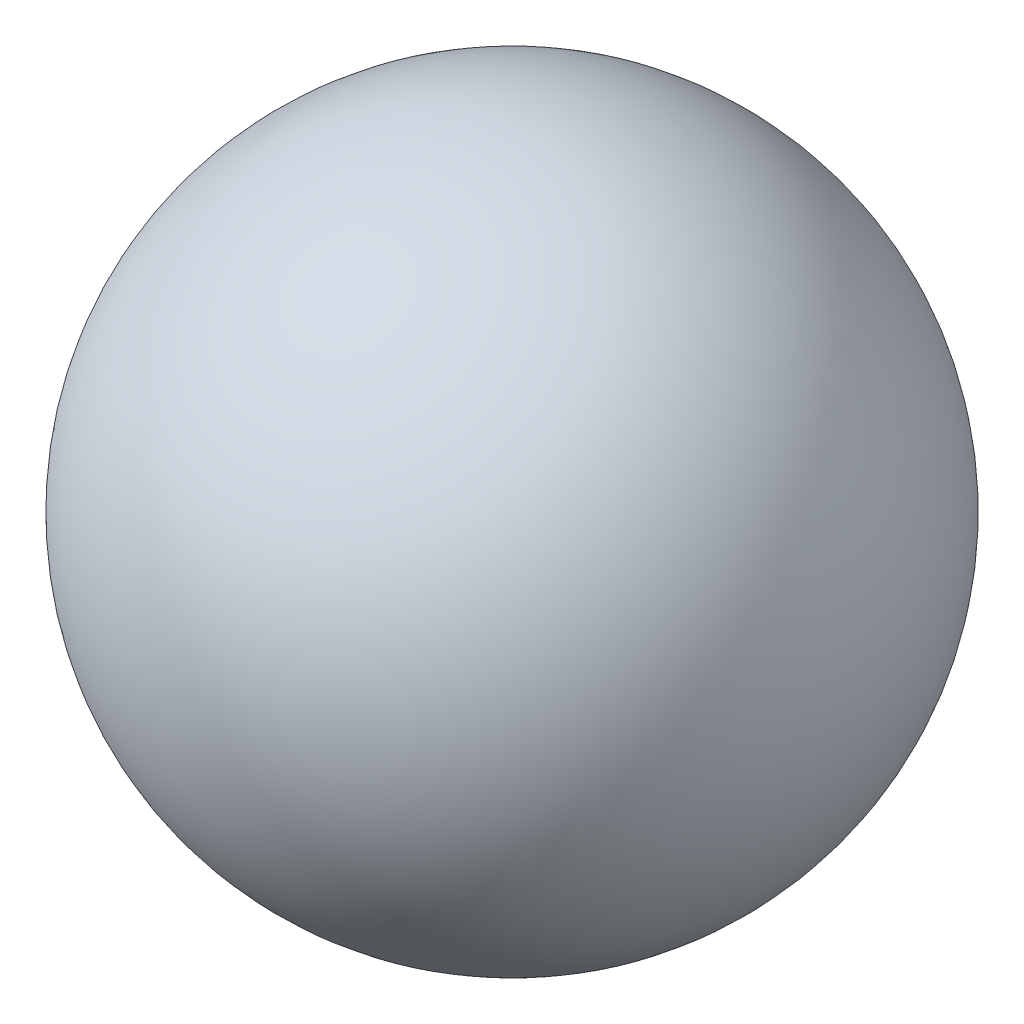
SolidWorks part; units mm, degrees
ref_plane "前视基准面" through (0, 0, 0) normal (0, 0, 1) x (1, 0, 0)
ref_plane "上视基准面" through (0, 0, 0) normal (0, 1, 0) x (1, 0, 0)
ref_plane "右视基准面" through (0, 0, 0) normal (1, 0, 0) x (0, 0, -1)
sketch "草图1" plane through (0, 0, 0) normal (0, 0, 1) x (1, 0, 0)
  line L0 (0, 2.49) -> (0, -2.49)
  arc A0 (0, 2.49) -> (0, -2.49) centre (0, 0) ccw
  dimension "D1" = 2.49
revolve "旋转1" add sketch "草图1" angle 360 about L0
ref_plane "基准面1" through (0, 10, 0) normal (0, 1, 0) x (1, 0, 0)
sketch "草图2" plane through (0, 0, 0) normal (0, 1, 0) x (1, 0, 0)
  circle A0 centre (0, 0) radius 3.8285
